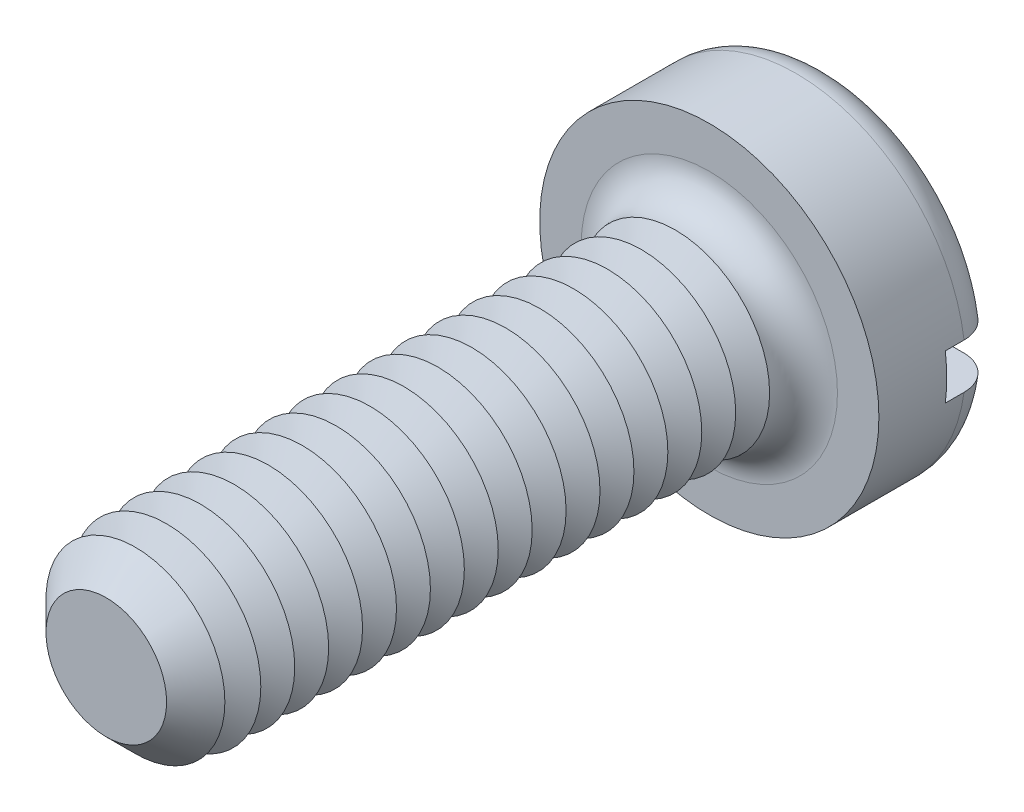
SolidWorks part; units mm, degrees
ref_plane "Front Plane" through (0, 0, 0) normal (0, 0, 1) x (1, 0, 0)
ref_plane "Top Plane" through (0, 0, 0) normal (0, 1, 0) x (1, 0, 0)
ref_plane "Right Plane" through (0, 0, 0) normal (1, 0, 0) x (0, 0, -1)
sketch "Sketch3" plane through (0, 0, 0) normal (0, 0, 1) x (1, 0, 0)
  circle A0 centre (0, 0) radius 2.25
  dimension "D1" = 4.5
extrude "Boss-Extrude2" add sketch "Sketch3" against normal blind 1.6
sketch "Sketch4" plane through (0, 0, 0) normal (0, 0, 1) x (1, 0, 0)
  circle A0 centre (0, 0) radius 1.25
  dimension "D1" = 2.5
extrude "Boss-Extrude3" add sketch "Sketch4" along normal blind 8
fillet "Fillet1" radius 0.45 2 edges at (2.25, 0, -1.6) (1.25, 0, 0)
chamfer "Chamfer1" distance 0.45 angle 45 1 edges at (1.25, 0, 8)
sketch "Sketch5" plane through (0, 0, 0) normal (1, 0, 0) x (0, 0, -1)
  line L0 (1.6944, 0) -> (-7.6738, 0) construction
sketch "Sketch6" plane through (0, 0, 0) normal (1, 0, 0) x (0, 0, -1)
  line L0 (-0.45, 1.25) -> (-0.675, 0.8603)
  line L1 (-0.675, 0.8603) -> (-0.9, 1.25)
  line L2 (-0.45, 1.25) -> (-7.55, 1.25) construction
  line L3 (-0.9, 1.25) -> (-0.45, 1.25)
  dimension "D1" = 0.45
revolve "Cut-Revolve1" cut sketch "Sketch6" angle 360 about L0
pattern_linear "LPattern1" count 16 spacing 0.45 along (0, 0, 1) of "Cut-Revolve1"
sketch "Sketch8" plane through (0, 0, -1.6) normal (0, 0, -1) x (-1, 0, 0)
  line L1 (2.25, -0.3) -> (-2.25, -0.3)
  line L2 (2.25, -0.3) -> (2.25, 0.3)
  line L3 (2.25, 0.3) -> (-2.25, 0.3)
  line L4 (-2.25, -0.3) -> (-2.25, 0.3)
  line L5 (2.25, -0.3) -> (-2.25, 0.3) construction
  line L6 (2.25, 0.3) -> (-2.25, -0.3) construction
  point P0 (0, 0)
  dimension "D1" = 4.5
  dimension "D2" = 0.6
extrude "Cut-Extrude1" cut sketch "Sketch8" against normal blind 0.7
